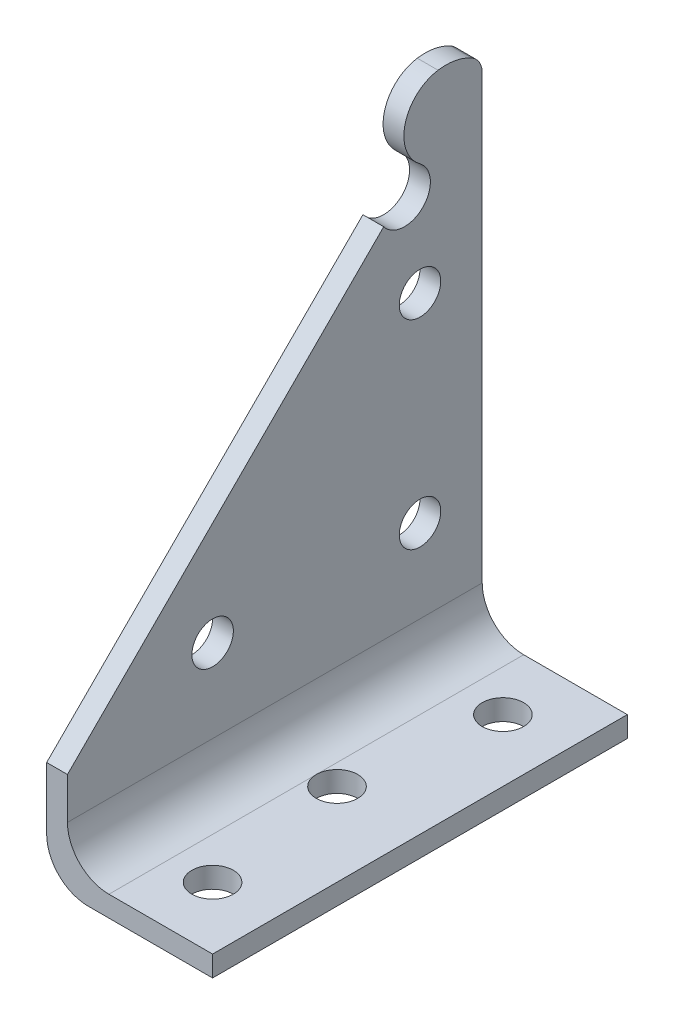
SolidWorks part; units mm, degrees
ref_plane "Front Plane" through (0, 0, 0) normal (0, 0, 1) x (1, 0, 0)
ref_plane "Top Plane" through (0, 0, 0) normal (0, 1, 0) x (1, 0, 0)
ref_plane "Right Plane" through (0, 0, 0) normal (1, 0, 0) x (0, 0, -1)
sketch "Sketch1" plane through (0, 0, 0) normal (0, 0, 1) x (1, 0, 0)
  line L0 (0, 0) -> (0, 81.28)
  line L1 (0, 81.28) -> (3.1826, 81.28)
  line L2 (3.1826, 81.28) -> (3.1826, 3.175)
  line L3 (3.1826, 3.175) -> (25.4, 3.175)
  line L4 (25.4, 3.175) -> (25.4, 0)
  line L5 (25.4, 0) -> (0, 0)
  dimension "D1" = 3.175
  dimension "D2" = 3.1826
  dimension "D3" = 81.28
  dimension "D4" = 25.4
extrude "Boss-Extrude1" add sketch "Sketch1" along normal mid plane 63.5
fillet "Fillet1" radius 6.35 1 edges at (0, 0, 0)
fillet "Fillet2" radius 6.35 1 edges at (3.1826, 3.175, 0)
sketch "Sketch2" plane through (3.1826, 0, 0) normal (1, 0, 0) x (0, 0, -1)
  line L0 (-31.75, 0) -> (31.75, 0) construction
  line L1 (-31.75, 9.525) -> (-31.75, 81.28) construction
  line L2 (31.75, 15.875) -> (-16.6695, 64.2945)
  line L3 (-31.75, 81.28) -> (31.75, 81.28) construction
  line L4 (31.75, 9.525) -> (31.75, 81.28) construction
  line L7 (-31.75, 3.175) -> (31.75, 3.175) construction
  line L8 (-16.6695, 64.2945) -> (-31.75, 79.375) construction
  line L9 (-31.75, 9.525) -> (31.75, 9.525) construction
  circle A0 centre (-22.225, 22.225) radius 3.175
  circle A1 centre (9.525, 22.225) radius 3.175
  circle A2 centre (-22.225, 52.705) radius 3.175
  arc A3 (-22.2255, 69.8505) -> (-16.6695, 64.2945) centre (-19.845, 66.675) ccw
  arc A4 (-22.2255, 69.8505) -> (-24.9925, 80.8837) centre (-25.9255, 74.7862) ccw
  arc A5 (-26.195, 80.9752) -> (-24.9925, 80.8837) centre (-26.195, 73.025) cw
  arc A6 (-26.195, 80.9752) -> (-30.154, 79.9194) centre (-26.195, 73.025) ccw
  arc A7 (-30.154, 79.9194) -> (-31.75, 77.1624) centre (-28.5709, 77.1624) ccw
  point P19 (-26.195, 73.025)
  point P24 (-26.195, 80.9752)
  dimension "D1" = 6.35
  dimension "D9" = 7.9375
  dimension "D13" = 80.9752
  dimension "D15" = 3.1791
  dimension "D2" = 22.225
  dimension "D3" = 9.525
  dimension "D4" = 31.75
  dimension "D5" = 30.48
  dimension "D6" = 66.675
  dimension "D7" = 45
  dimension "D8" = 12.7
  dimension "D10" = 11.905
  dimension "D11" = 5.555
  dimension "D12" = 73.025
extrude "Cut-Extrude1" cut sketch "Sketch2" against normal through all contours L8 L2 A7 A6 A5 A4 M3 M4 M1 | A3 L8 | A7 L8 M1 | A2 | A0 | A1
sketch "Sketch3" plane through (0, 3.175, 0) normal (0, 1, 0) x (1, 0, 0)
  line L0 (25.4, -31.75) -> (25.4, 31.75) construction
  line L1 (25.4, -31.75) -> (9.5326, -31.75) construction
  line L2 (25.4, 31.75) -> (9.5326, 31.75) construction
  circle A0 centre (15.875, -22.225) radius 3.175
  circle A1 centre (12.7, 0) radius 3.175
  circle A2 centre (15.875, 22.225) radius 3.175
  dimension "D1" = 6.35
  dimension "D2" = 9.525
  dimension "D3" = 12.7
  dimension "D4" = 9.525
  dimension "D5" = 31.75
  dimension "D6" = 9.525
extrude "Cut-Extrude2" cut sketch "Sketch3" against normal through all
move or copy body "Body-Move/Copy1" bodies to move or copy 104
